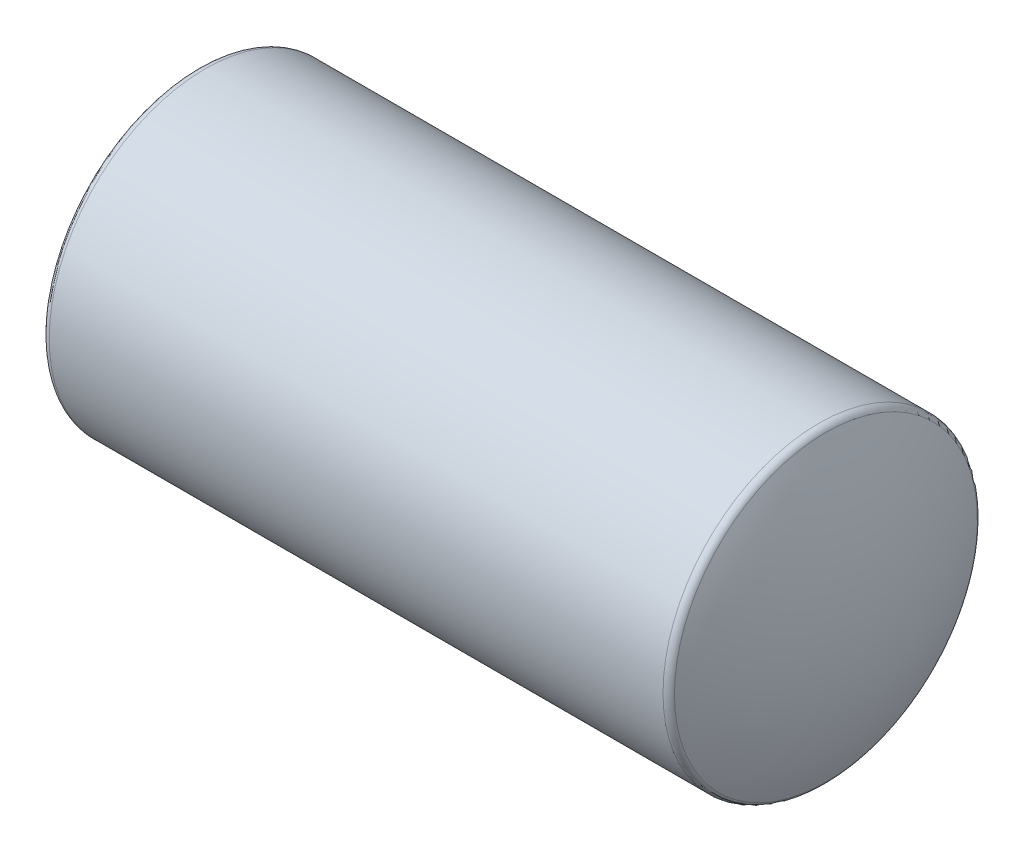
SolidWorks part; units mm, degrees
ref_plane "Спереди" through (0, 0, 0) normal (0, 0, 1) x (1, 0, 0)
ref_plane "Сверху" through (0, 0, 0) normal (0, 1, 0) x (1, 0, 0)
ref_plane "Справа" through (0, 0, 0) normal (1, 0, 0) x (0, 0, -1)
sketch "Эскиз1" plane through (0, 0, 0) normal (0, 0, 1) x (1, 0, 0)
  line L0 (-8.9443, 0) -> (8.9443, 0)
  line L1 (-8, 4) -> (8, 4)
  line L2 (0, 0) -> (0, 4) construction
  arc A0 (-8, 4) -> (-8.9443, 0) centre (0, 0) ccw
  arc A1 (8.9443, 0) -> (8, 4) centre (0, 0) ccw
  dimension "D1" = 16
  dimension "D2" = 4
revolve "Повернуть1" add sketch "Эскиз1" angle 360 about L0
fillet "Скругление1" radius 0.2 2 edges at (-8, 0, 4) (8, 0, 4)
